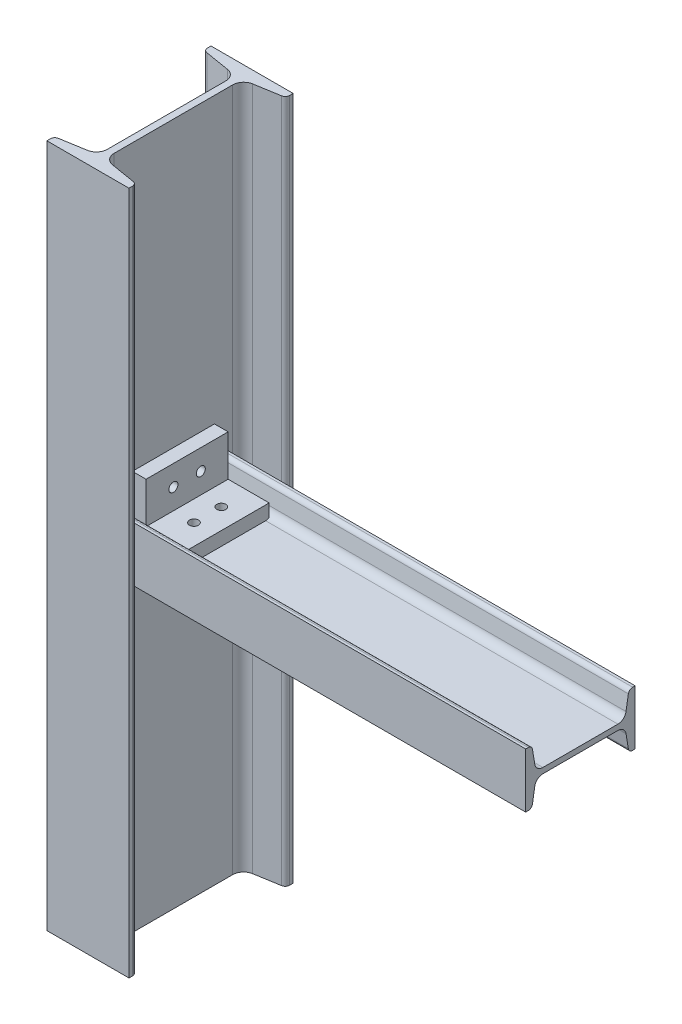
SolidWorks part; units mm, degrees
other "<Part3>-<M6 Clearance Hole2>"
other "<hex flange machine screw_am>-<Indent>"
ref_plane "Front Plane" through (0, 0, 0) normal (0, 0, 1) x (1, 0, 0)
ref_plane "Top Plane" through (0, 0, 0) normal (0, 1, 0) x (1, 0, 0)
ref_plane "Right Plane" through (0, 0, 0) normal (1, 0, 0) x (0, 0, -1)
other "Configuration Table"
sketch "Sketch1" plane through (0, 0, 0) normal (0, 0, 1) x (1, 0, 0)
  line L0 (0, 250) -> (0, -250)
  line L1 (0, 0) -> (300, 0)
  dimension "D1" = 500
  dimension "D2" = 300
other "Structure System1"
sketch3d "Structure System Grid1"
  line L0 (0, 250, 0) -> (0, -250, 0)
  line L1 (0, 0, 0) -> (300, 0, 0)
other "<ISO><sb beam><120 X 12>(1)"
ref_plane "Plane1" through (0, 250, 0) normal (0, -1, 0) x (1, 0, 0)
sketch "Sketch11" plane through (0, 250, 0) normal (0, -1, 0) x (1, 0, 0)
  line L0 (-30, -60) -> (-30, -57.3814)
  line L1 (-27.347, -54.2496) -> (-9.1847, -51.2224)
  line L2 (-2.5, -43.3312) -> (-2.5, 43.3312)
  line L3 (-9.1847, 51.2224) -> (-27.347, 54.2496)
  line L4 (-30, 57.3814) -> (-30, 60)
  line L5 (-30, 60) -> (30, 60)
  line L6 (30, 60) -> (30, 57.3814)
  line L7 (27.347, 54.2496) -> (9.1847, 51.2224)
  line L8 (2.5, 43.3312) -> (2.5, -43.3312)
  line L9 (9.1847, -51.2224) -> (27.347, -54.2496)
  line L10 (30, -57.3814) -> (30, -60)
  line L11 (30, -60) -> (-30, -60)
  line L14 (6.0938, -52.4) -> (-4.15, -52.4) construction
  line L15 (-2.5, 0) -> (2.5, 0) construction
  arc A0 (-9.1847, -51.2224) -> (-2.5, -43.3312) centre (-10.5, -43.3312) ccw
  arc A1 (-2.5, 43.3312) -> (-9.1847, 51.2224) centre (-10.5, 43.3312) ccw
  arc A2 (9.1847, 51.2224) -> (2.5, 43.3312) centre (10.5, 43.3312) ccw
  arc A3 (2.5, -43.3312) -> (9.1847, -51.2224) centre (10.5, -43.3312) ccw
  arc A4 (30, -57.3814) -> (27.347, -54.2496) centre (26.825, -57.3814) ccw
  arc A5 (-30, -57.3814) -> (-27.347, -54.2496) centre (-26.825, -57.3814) cw
  arc A6 (-27.347, 54.2496) -> (-30, 57.3814) centre (-26.825, 57.3814) cw
  arc A7 (27.347, 54.2496) -> (30, 57.3814) centre (26.825, 57.3814) ccw
  point P21 (0, 60)
  point P23 (0, -60)
  point P35 (0, 0)
  dimension "D7" = 9.463
  dimension "RI" = 8
  dimension "D2" = 3.175
  dimension "BF" = 60
  dimension "D6" = 9.463
  dimension "DEPTH" = 120
  dimension "TW" = 5
  dimension "D1" = 86.6625
  dimension "TF" = 7.6
other "Member1"
other "<ISO><sb beam><80 X 6>(1)"
ref_plane "Plane2" through (0, 0, 0) normal (1, 0, 0) x (0, 1, 0)
sketch "Sketch12" plane through (0, 0, 0) normal (1, 0, 0) x (0, 1, 0)
  line L0 (-20, -40) -> (-20, -38.1895)
  line L1 (-17.347, -35.0577) -> (-7.0135, -33.3354)
  line L2 (-2, -27.417) -> (-2, 27.417)
  line L3 (-7.0135, 33.3354) -> (-17.347, 35.0577)
  line L4 (-20, 38.1895) -> (-20, 40)
  line L5 (-20, 40) -> (20, 40)
  line L6 (20, 40) -> (20, 38.1895)
  line L7 (17.347, 35.0577) -> (7.0135, 33.3354)
  line L8 (2, 27.417) -> (2, -27.417)
  line L9 (7.0135, -33.3354) -> (17.347, -35.0577)
  line L10 (20, -38.1895) -> (20, -40)
  line L11 (20, -40) -> (-20, -40)
  line L14 (3.5938, -34) -> (-6.65, -34) construction
  line L15 (-2, 0) -> (2, 0) construction
  arc A0 (-7.0135, -33.3354) -> (-2, -27.417) centre (-8, -27.417) ccw
  arc A1 (-2, 27.417) -> (-7.0135, 33.3354) centre (-8, 27.417) ccw
  arc A2 (7.0135, 33.3354) -> (2, 27.417) centre (8, 27.417) ccw
  arc A3 (2, -27.417) -> (7.0135, -33.3354) centre (8, -27.417) ccw
  arc A4 (20, -38.1895) -> (17.347, -35.0577) centre (16.825, -38.1895) ccw
  arc A5 (-20, -38.1895) -> (-17.347, -35.0577) centre (-16.825, -38.1895) cw
  arc A6 (-17.347, 35.0577) -> (-20, 38.1895) centre (-16.825, 38.1895) cw
  arc A7 (17.347, 35.0577) -> (20, 38.1895) centre (16.825, 38.1895) ccw
  point P21 (0, 40)
  point P23 (0, -40)
  point P35 (0, 0)
  dimension "D7" = 9.463
  dimension "RI" = 6
  dimension "D2" = 3.175
  dimension "BF" = 40
  dimension "D6" = 9.463
  dimension "DEPTH" = 80
  dimension "TW" = 4
  dimension "D1" = 54.834
  dimension "TF" = 6
other "Member2"
ref_plane "Vertical Plane(Member2)" through (0, 0, -40) normal (0, -1, 0) x (1, 0, 0)
other "Corner Management1"
other "Simple Corner Group1"
other "Corner1"
ref_plane "Front Plane-Part3" through (2.5, 2, 0) normal (0, 0, 1) x (1, 0, 0)
ref_plane "Top Plane-Part3" through (2.5, 2, 0) normal (0, 1, 0) x (1, 0, 0)
ref_plane "Right Plane-Part3" through (2.5, 2, 0) normal (1, 0, 0) x (0, 0, -1)
inserted part "Part3"
move or copy body "Body-Move/Copy4"
other "Connection Element Part32"
inserted part "hex flange machine screw_am"
move or copy body "Body-Move/Copy7" bodies to move or copy 114 placed by mates yes
delete or keep bodies "Body-Delete/Keep 1" type delete bodies bodies 115
